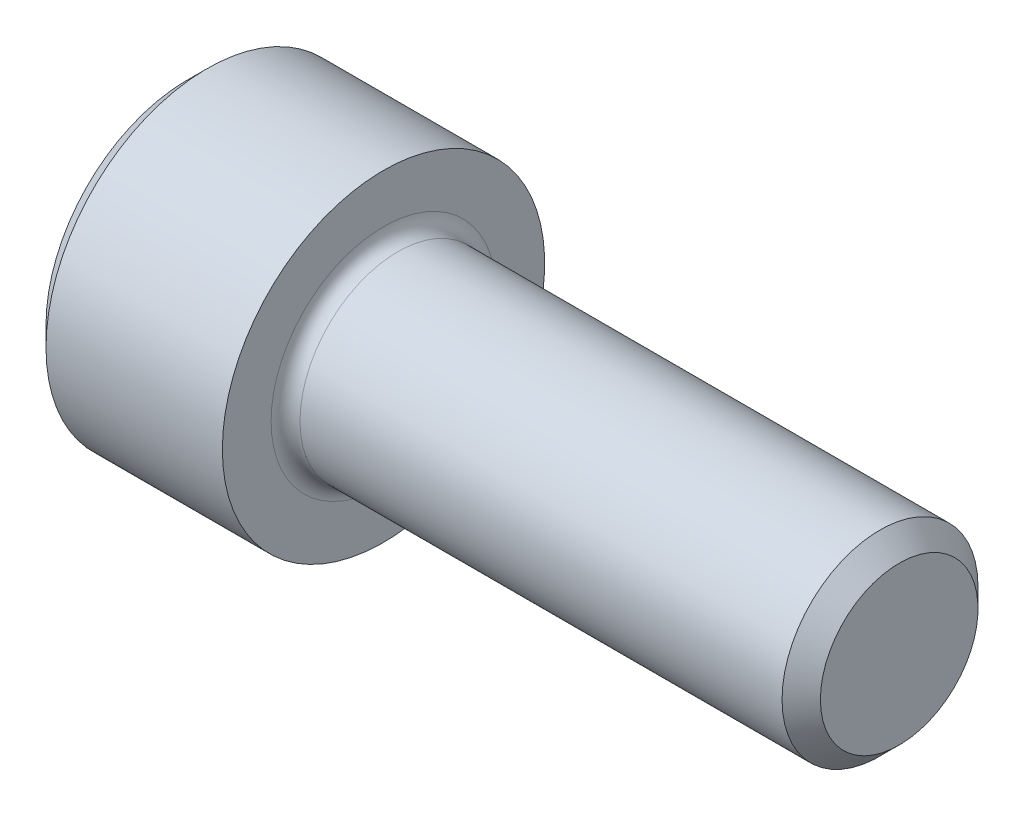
SolidWorks part; units mm, degrees
ref_plane "Plane1"
ref_plane "Plane2" through (0, 0, 0) normal (0, 1, 0) x (1, 0, 0)
ref_plane "Plane3" through (0, 0, 0) normal (1, 0, 0) x (0, 0, -1)
sketch "BodySke" plane through (0, 0, 0) normal (0, 0, 1) x (1, 0, 0)
  line L0 (0, 0) -> (0, 3.4861)
  line L1 (0.4826, 3.9688) -> (4.826, 3.9688)
  line L2 (4.826, 3.9688) -> (4.826, 2.413)
  line L3 (4.826, 2.413) -> (17.0536, 2.413)
  line L4 (17.526, 1.9406) -> (17.526, 0)
  line L5 (17.526, 0) -> (0, 0)
  line L6 (-31.75, 0) -> (127, 0) construction
  line L7 (0, 3.4861) -> (0.4826, 3.9688)
  line L8 (17.526, 1.9406) -> (17.0536, 2.413)
  line L9 (0, -3.4861) -> (0.4826, -3.9688) construction
  line L10 (17.526, -1.9406) -> (17.0536, -2.413) construction
  line L11 (5.6185, 9.525) -> (5.6185, 3.175) construction
  line L12 (4.826, 9.525) -> (4.826, 3.175) construction
  line L13 (-20.574, 9.525) -> (-20.574, 3.175) construction
  dimension "Diameter" = 4.826
  dimension "Head_ht" = 4.826
  dimension "Length" = 12.7
  dimension "Body_ch_ang" = 45
  dimension "Head_dia" = 7.9375
  dimension "Head_ch_ang" = 45
  dimension "Head_side_ht" = 4.3434
  dimension "Minor_dia" = 3.8811
  dimension "Advance" = 0.7925
  dimension "Thread_nom" = 12.7
  dimension "Thread_length" = 38.1
revolve "Base-Revolve" add sketch "BodySke"
fillet "Fillet1" radius 0.3556 1 edges at (4.826, 0, 2.413)
sketch "Sketch2" plane through (0, 0, 0) normal (0, 0, 1) x (1, 0, 0)
  line L0 (0, 1.985) -> (2.286, 1.985)
  line L1 (2.286, 1.985) -> (3.432, 0)
  line L2 (-31.75, 0) -> (127, 0) construction
  line L3 (3.432, 0) -> (0, 0)
  line L4 (0, 0) -> (0, 1.985)
  line L5 (0, 3.4861) -> (0, -3.4861) construction
  line L6 (0, 0) -> (47.625, 0) construction
  line L7 (4.826, -3.9688) -> (4.826, 3.9688) construction
  dimension "D1" = 1.985
  dimension "D2" = 60
  dimension "Wall_thickness" = 2.54
revolve "Hex-PreBroach" cut sketch "Sketch2" angle 360 about L6
sketch "Sketch3" plane through (0, 0, 0) normal (-1, 0, 0) x (0, 0.5, 0.866)
  line L0 (1.146, 1.985) -> (-1.146, 1.985)
  line L1 (-1.146, 1.985) -> (-2.2921, 0)
  line L2 (1.146, 1.985) -> (2.2921, 0)
  line L3 (1.146, -1.985) -> (2.2921, 0)
  line L4 (1.146, -1.985) -> (-1.146, -1.985)
  line L5 (-1.146, -1.985) -> (-2.2921, 0)
  dimension "D1" = 1.985
  dimension "D2" = 1.985
  dimension "Hex_size" = 3.97
extrude "Hex" cut sketch "Sketch3" against normal blind 2.286
sketch "Sketch4" plane through (0, 0, 0) normal (-1, 0, 0) x (0, 0, 1)
  line L0 (0, 0) -> (2.3876, 0)
  line L1 (0, 0) -> (6.1484, 3.5498) construction
  line L2 (0, 0) -> (1.1938, 2.0677)
  line L3 (1.9883, 0.576) -> (2.2704, 0.7389)
  line L4 (1.493, 1.4339) -> (1.7751, 1.5968)
  arc A0 (1.9883, 0.576) -> (1.493, 1.4339) centre (0, 0) ccw
  arc A1 (2.3876, 0) -> (2.2704, 0.7389) centre (0, 0) ccw
  arc A2 (1.1938, 2.0677) -> (1.7751, 1.5968) centre (0, 0) cw
  dimension "D1" = 30
  dimension "Spline_n_dim" = 4.1402
  dimension "Spline_m_dim" = 4.7752
  dimension "D2" = 60
  dimension "D3" = 0.4953
  dimension "Spline_p_dim" = 0.9906
extrude "Spline" [suppressed] cut sketch "Sketch4" against normal blind 2.286
pattern_circular "CirPattern1" [suppressed] count 6 every 60
sketch "Sketch5" plane through (0, 0, 0) normal (0, 0, 1) x (1, 0, 0)
  line L0 (-31.75, 0) -> (127, 0) construction
  line L2 (0, 3.4861) -> (0, -3.4861) construction
  circle A0 centre (1.651, 0) radius 0.5905
  dimension "Drilled_hole_dia" = 1.1811
  dimension "Drilled_hole_loc" = 1.651
extrude "Hole" [suppressed] cut sketch "Sketch5" against normal through all and the other way through all
pattern_circular "Drilled-4" [suppressed] count 2 every 60
pattern_circular "Drilled-6" [suppressed] count 3 every 60
sketch "ThdSchSke" plane through (0, 0, 0) normal (0, 0, 1) x (1, 0, 0)
  line L0 (5.6185, -1.9406) -> (5.2877, -2.413)
  line L1 (5.6185, -1.9406) -> (5.9493, -2.413)
  line L2 (5.9493, -2.413) -> (5.9493, -3.0163)
  line L3 (-3.175, 0) -> (5.1513, 0) construction
  line L5 (5.9493, -3.0163) -> (5.2877, -3.0163)
  line L6 (5.2877, -3.0163) -> (5.2877, -2.413)
  line L7 (0, 3.4861) -> (0, -3.4861) construction
  dimension "Thread_minor" = 3.8811
  dimension "Diameter" = 4.826
  dimension "Start" = 5.6185
  dimension "SideAngle" = 55
  dimension "VeeAngle" = 70
  dimension "Overcut" = 6.0325
revolve "ThreadSchematic" [suppressed] cut sketch "ThdSchSke" angle 360 about L3
pattern_linear "ThdSchPat" [suppressed]
equation "\"D2@Sketch3\" = \"Hex_size@Sketch3\" / 2"
equation "\"D1@Sketch3\" = \"Hex_size@Sketch3\" / 2"
equation "\"D1@Sketch2\" = \"Hex_size@Sketch3\" / 2"
equation "\"D3@Sketch4\" = \"Spline_p_dim@Sketch4\" / 2"
equation "\"Thread_minor@ThreadCosmetic\"  =  \"Minor_dia@BodySke\""
equation "\"D2@CirPattern1\" = 360 / \"Num_teeth@CirPattern1\""
equation "\"Wall_thickness@Sketch2\" = \"Head_ht@BodySke\" - \"Key_eng@Hex\""
equation "\"Thread_length@ThreadCosmetic\" = ((sgn( (\"Length@BodySke\" - \"Advance@BodySke\" ) - \"Thread_nom@BodySke\" )-1)*( (\"Length@BodySke\" - \"Advance@BodySke\" ) - \"Thread_nom@BodySke\" ))/-2+ \"Thread_nom@BodySke\""
equation "\"Thread_minor@ThdSchSke\" = \"Minor_dia@BodySke\""
equation "\"Diameter@ThdSchSke\" = \"Diameter@BodySke\""
equation "\"Overcut@ThdSchSke\" = \"Diameter@BodySke\" * 1.25"
equation "\"Start@ThdSchSke\" = \"Head_ht@BodySke\" + \"Length@BodySke\" - \"Thread_length@ThreadCosmetic\"  '---Non-countersunk---"
equation "\"Num_threads@ThdSchPat\" = int( \"Thread_length@ThreadCosmetic\" / \"Advance@BodySke\" + 0.999 )  + 1"
equation "\"Advance@ThdSchPat\" = \"Thread_length@ThreadCosmetic\" /  (\"Num_threads@ThdSchPat\" - 1) 'relax it"
equation "\"Num_threads@ThdSchPat\" = \"Num_threads@ThdSchPat\" - sgn( \"Num_threads@ThdSchPat\" - 1) '---chamfered tips only---"
